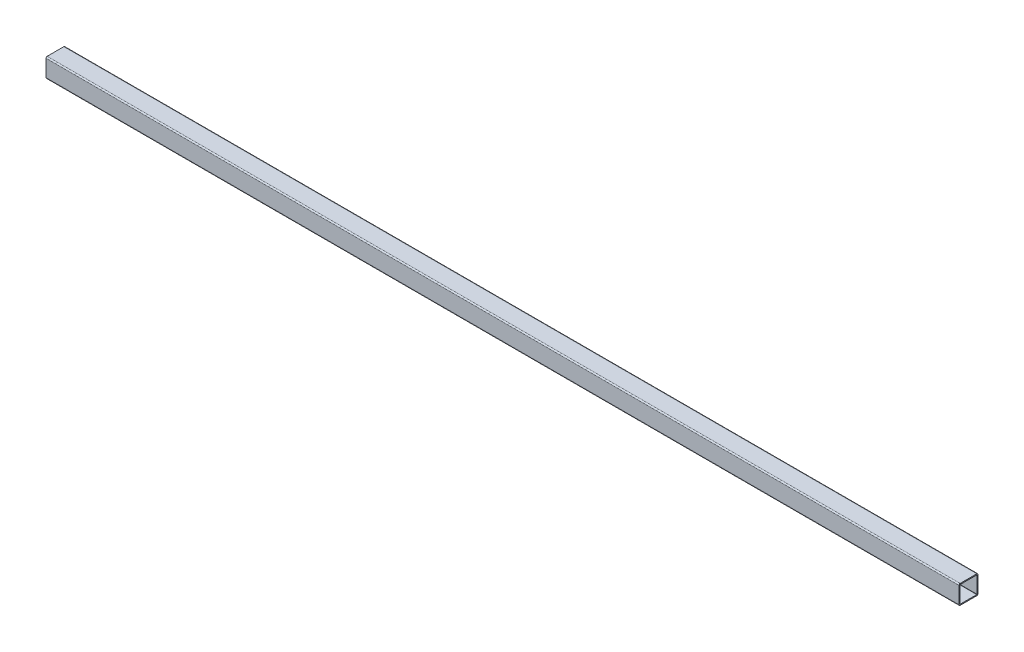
SolidWorks part; units mm, degrees
ref_plane "Front Plane" through (0, 0, 0) normal (0, 0, 1) x (1, 0, 0)
ref_plane "Top Plane" through (0, 0, 0) normal (0, 1, 0) x (1, 0, 0)
ref_plane "Right Plane" through (0, 0, 0) normal (1, 0, 0) x (0, 0, -1)
sketch "Sketch1" plane through (0, 0, 0) normal (1, 0, 0) x (0, 0, -1)
  line L0 (-5.373, 3.898) -> (16.852, 3.898)
  line L1 (-5.373, 5.2442) -> (16.852, 5.2442)
  line L2 (-6.9605, 3.6567) -> (-6.9605, -18.5683)
  line L3 (-5.373, -20.1558) -> (16.852, -20.1558)
  line L4 (18.4395, 3.6567) -> (18.4395, -18.5683)
  line L5 (17.0933, 3.6567) -> (17.0933, -18.5683)
  line L6 (-5.373, -18.8096) -> (16.852, -18.8096)
  line L7 (-5.6143, 3.6567) -> (-5.6143, -18.5683)
  arc A0 (16.852, 5.2442) -> (18.4395, 3.6567) centre (16.852, 3.6567) cw
  arc A1 (-6.9605, 3.6567) -> (-5.373, 5.2442) centre (-5.373, 3.6567) cw
  arc A2 (-5.373, -20.1558) -> (-6.9605, -18.5683) centre (-5.373, -18.5683) cw
  arc A3 (18.4395, -18.5683) -> (16.852, -20.1558) centre (16.852, -18.5683) cw
  arc A4 (16.852, 3.898) -> (17.0933, 3.6567) centre (16.852, 3.6567) cw
  arc A5 (17.0933, -18.5683) -> (16.852, -18.8096) centre (16.852, -18.5683) cw
  arc A6 (-5.373, -18.8096) -> (-5.6143, -18.5683) centre (-5.373, -18.5683) cw
  arc A7 (-5.6143, 3.6567) -> (-5.373, 3.898) centre (-5.373, 3.6567) cw
  point P6 (18.4395, 5.2442)
  point P9 (-6.9605, 5.2442)
  point P14 (18.4395, -20.1558)
  dimension "D3" = 1.5875
  dimension "D1" = 25.4
  dimension "D2" = 25.4
  dimension "D4" = 1.3462
extrude "Extrude1" add sketch "Sketch1" along normal blind 1219.2
